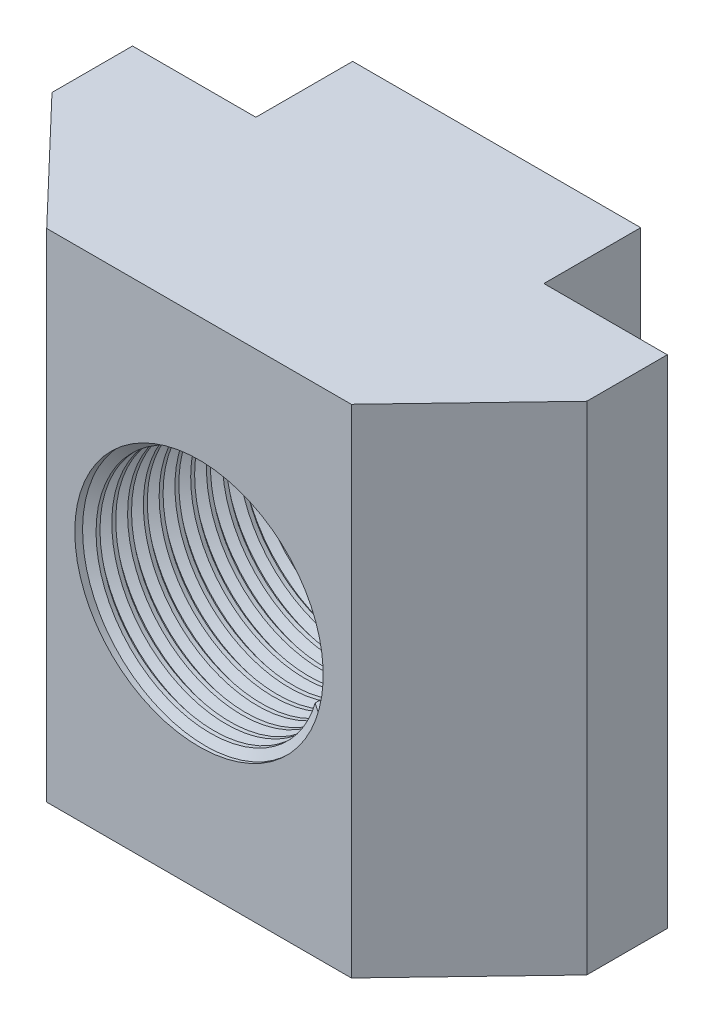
SolidWorks part; units mm, degrees
ref_plane "Front Plane" through (0, 0, 0) normal (0, 0, 1) x (1, 0, 0)
ref_plane "Top Plane" through (0, 0, 0) normal (0, 1, 0) x (1, 0, 0)
ref_plane "Right Plane" through (0, 0, 0) normal (1, 0, 0) x (0, 0, -1)
sketch "Sketch3" plane through (0, 0, 0) normal (0, 1, 0) x (1, 0, 0)
  line L0 (-16.7483, -3.3486) -> (-14.2649, -3.3486)
  line L1 (-14.2649, -3.3486) -> (-14.2649, -1.4007)
  line L2 (-16.7483, -3.3486) -> (-16.7483, -4.9688)
  line L3 (-16.7483, -4.9688) -> (-14.4315, -7.3917)
  line L4 (-14.4315, -7.3917) -> (-8.3015, -7.3917)
  line L5 (-14.2649, -1.4007) -> (-8.4681, -1.4007)
  line L6 (-5.9847, -4.9688) -> (-8.3015, -7.3917)
  line L7 (-5.9847, -3.3486) -> (-5.9847, -4.9688)
  line L8 (-5.9847, -3.3486) -> (-8.4681, -3.3486)
  line L9 (-8.4681, -3.3486) -> (-8.4681, -1.4007)
  point P7 (-11.3665, -7.3917)
extrude "Boss-Extrude3" add sketch "Sketch3" along normal blind 10
sketch "Sketch4" plane through (0, 0, 1.4007) normal (0, 0, -1) x (-1, 0, 0)
  line L0 (8.4681, 5) -> (14.2649, 5)
  line L1 (8.4681, 10) -> (8.4681, 0) construction
  line L2 (14.2649, 10) -> (14.2649, 0) construction
  circle A0 centre (11.3665, 5) radius 2.5
extrude "Cut-Extrude1" cut sketch "Sketch4" against normal through all contours L0 A0 | L0 A0
thread "Thread2" pitch 0.3175 start angle 0, offset 0, length 5.7, pitch 0.3175, diameter 5
ref_plane "Plane3" through (-8.8665, 5, 1.4007) normal (0, -1, 0) x (1, 0, 0)
sketch "Thread Profile3" plane through (-8.8665, 5, 1.4007) normal (0, -1, 0) x (1, 0, 0)
  line L0 (0, 0) -> (0, 0.3175) construction
  line L11 (0, 0) -> (0, 0.2778)
  line L12 (0, 0.2778) -> (-0.1719, 0.1786)
  line L13 (-0.1719, 0.1786) -> (-0.1719, 0.0992)
  line L15 (-0.1719, 0.0992) -> (0, 0)
  line L17 (-0.1719, 0.1389) -> (0, 0.1389) construction
  point P2 (0, 0)
  dimension "Pitch" = 0.3175
  dimension "Profile_Angle" = 60
  dimension "Profile_Land" = 0.0794
  dimension "Profile_Height" = 0.1719
